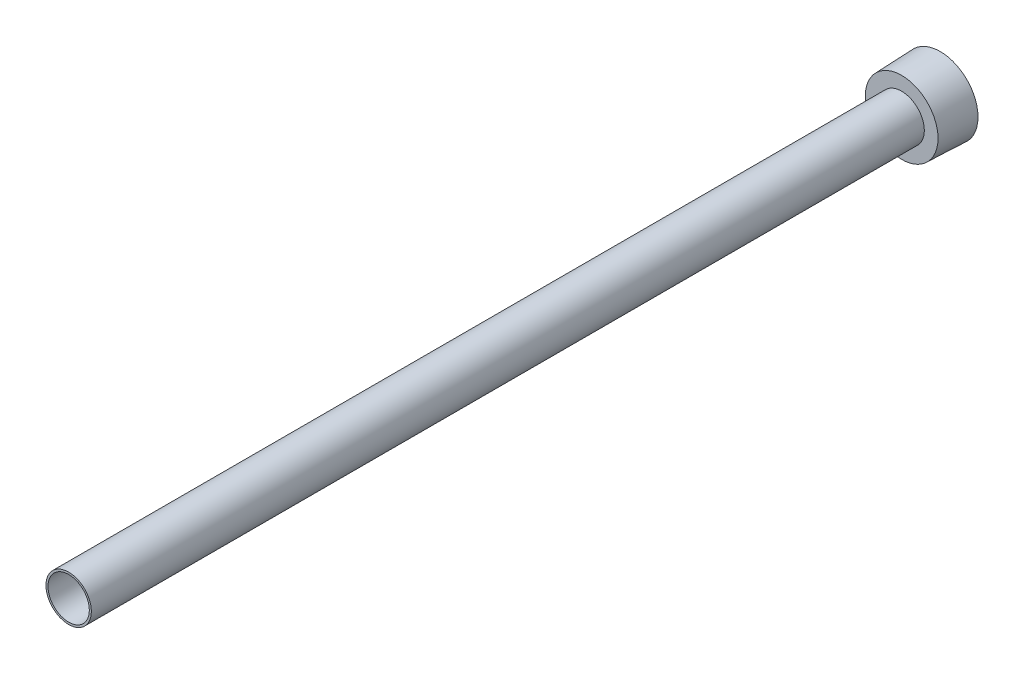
SolidWorks part; units mm, degrees
ref_plane "Front Plane" through (0, 0, 0) normal (0, 0, 1) x (1, 0, 0)
ref_plane "Top Plane" through (0, 0, 0) normal (0, 1, 0) x (1, 0, 0)
ref_plane "Right Plane" through (0, 0, 0) normal (1, 0, 0) x (0, 0, -1)
sketch "Sketch1" plane through (0, 0, 0) normal (1, 0, 0) x (0, 0, -1)
  line L0 (-278.0011, 0) -> (49721.9989, 0) construction
  line L1 (-304.8, 0) -> (0, 0)
  line L6 (0, 0) -> (0, 13.2207)
  line L7 (0, 13.2207) -> (-13.4874, 12.7287)
  line L8 (-13.4874, 12.7287) -> (-13.4874, 7.9375)
  line L9 (-13.4874, 7.9375) -> (-304.8, 7.9375)
  line L10 (-304.8, 7.9375) -> (-304.8, 0)
  dimension "D1" = 13.4874
  dimension "D2" = 26.4414
  dimension "D3" = 2.089
  dimension "D4" = 15.875
  dimension "D5" = 304.8
revolve "Revolve1" add sketch "Sketch1" angle 360 about L0
sketch "Sketch2" plane through (0, 0, 304.8) normal (0, 0, 1) x (1, 0, 0)
  circle A0 centre (0, 0) radius 7.2263
  dimension "D1" = 14.4526
extrude "Cut-Extrude1" cut sketch "Sketch2" against normal through all
sketch "Sketch3" plane through (0, 0, 0) normal (0, 0, -1) x (-1, 0, 0)
  line L0 (0, 14.5428) -> (0, -14.5428) construction
  line L1 (-9.525, -5.4993) -> (0, -10.9985)
  line L2 (0, -10.9985) -> (9.525, -5.4993)
  line L3 (9.525, -5.4993) -> (9.525, 5.4993)
  line L4 (9.525, 5.4993) -> (0, 10.9985)
  line L5 (0, 10.9985) -> (-9.525, 5.4993)
  line L6 (-9.525, 5.4993) -> (-9.525, -5.4993)
  circle A0 centre (0, 0) radius 9.525 construction
  dimension "D1" = 19.05
extrude "Cut-Extrude2" cut sketch "Sketch3" against normal blind 9.525
